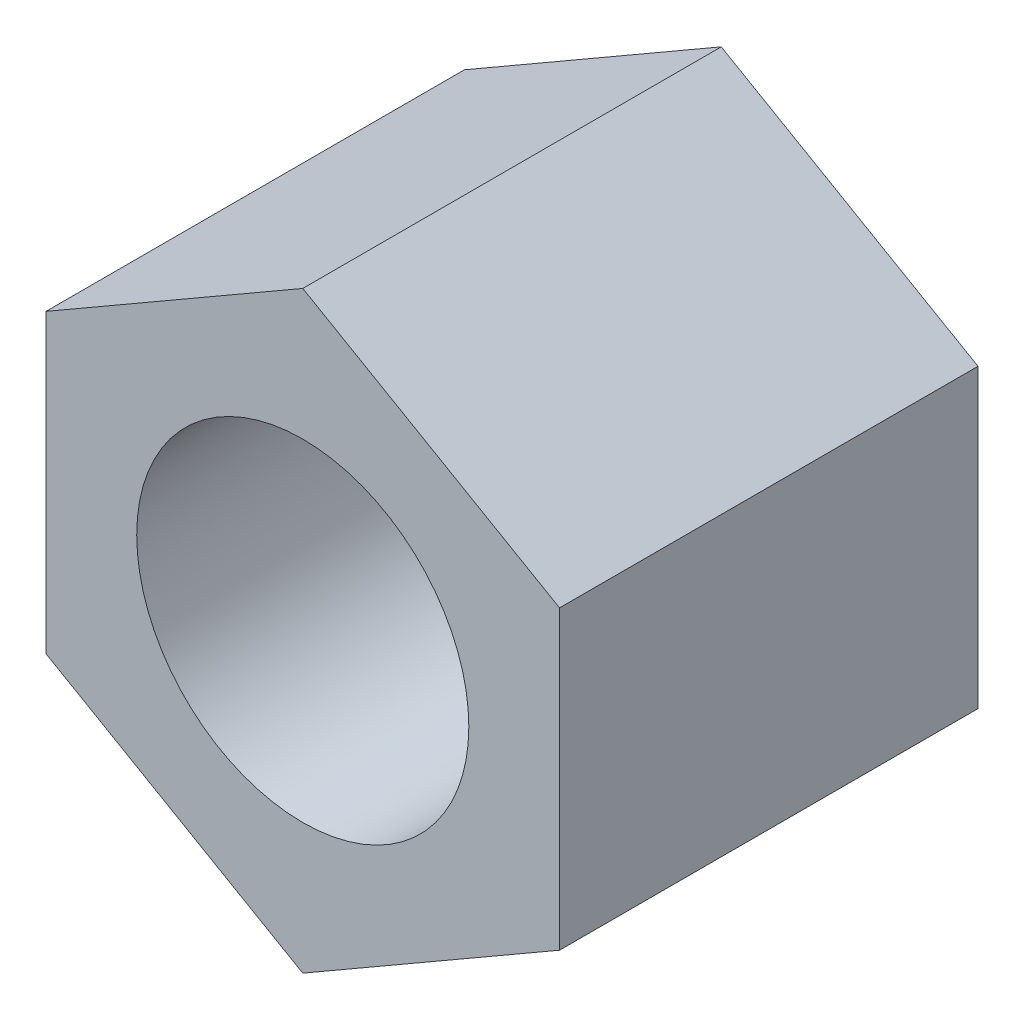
SolidWorks part; units mm, degrees
ref_plane "Front Plane" through (0, 0, 0) normal (1, 0, 0) x (0, 1, 0)
ref_plane "Top Plane" through (0, 0, 0) normal (0, 0, 1) x (0, 1, 0)
ref_plane "Right Plane" through (0, 0, 0) normal (0, 1, 0) x (-1, 0, 0)
sketch "Sketch1" plane through (0, 0, 0) normal (0, 0, 1) x (0, 1, 0)
  line L1 (19.8413, -34.3662) -> (39.6827, 0)
  line L2 (39.6827, 0) -> (19.8413, 34.3662)
  line L3 (19.8413, 34.3662) -> (-19.8413, 34.3662)
  line L4 (-19.8413, 34.3662) -> (-39.6827, 0)
  line L5 (-39.6827, 0) -> (-19.8413, -34.3662)
  line L6 (-19.8413, -34.3662) -> (19.8413, -34.3662)
  circle A0 centre (0, 0) radius 22.225
  circle A1 centre (0, 0) radius 34.3662 construction
  dimension "D1" = 44.45
  dimension "D2" = 68.7324
extrude "Nut body" add sketch "Sketch1" along normal blind 56.007
